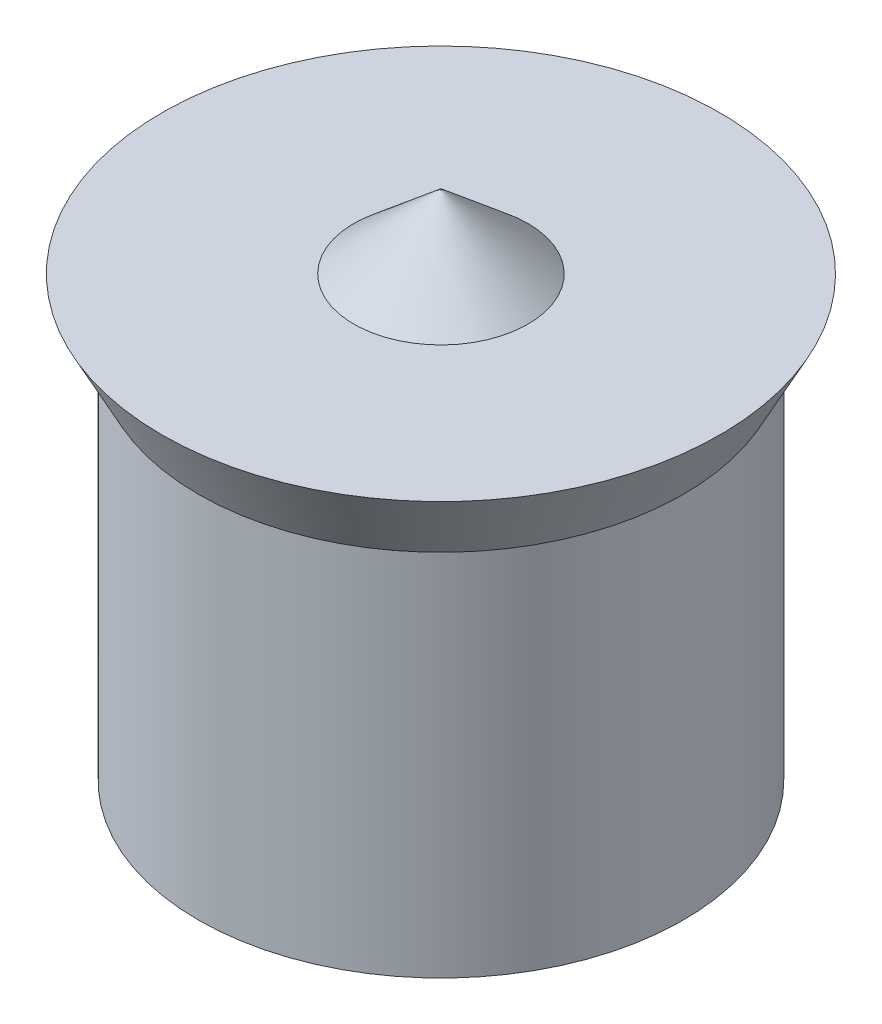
SolidWorks part; units mm, degrees
ref_plane "Front Plane" through (0, 0, 0) normal (0, 0, 1) x (1, 0, 0)
ref_plane "Top Plane" through (0, 0, 0) normal (0, 1, 0) x (1, 0, 0)
ref_plane "Right Plane" through (0, 0, 0) normal (1, 0, 0) x (0, 0, -1)
sketch "Sketch1" plane through (0, 0, 0) normal (0, 1, 0) x (1, 0, 0)
  circle A0 centre (0, 0) radius 36.5
  dimension "D1" = 73
extrude "Boss-Extrude1" add sketch "Sketch1" along normal blind 55.5
ref_plane "Plane1" through (0, 66, 0) normal (0, 1, 0) x (1, 0, 0)
sketch "Sketch2" plane through (0, 66, 0) normal (0, 1, 0) x (1, 0, 0)
  circle A0 centre (0, 0) radius 42
  dimension "D1" = 84
loft "Loft3" add profiles "Sketch2"
ref_plane "Plane2" through (0, -21, 0) normal (0, -1, 0) x (-1, 0, 0)
sketch "Sketch3" plane through (0, -21, 0) normal (0, -1, 0) x (-1, 0, 0)
  circle A0 centre (0, 0) radius 2.5
  dimension "D1" = 5
loft "Loft4" add profiles "Sketch3"
ref_plane "Plane3" through (0, 77, 0) normal (0, -1, 0) x (-1, 0, 0)
sketch "Sketch4" plane through (0, 77, 0) normal (0, -1, 0) x (-1, 0, 0)
  circle A0 centre (0, 0) radius 0.1173
sketch "Sketch5" plane through (0, 66, 0) normal (0, 1, 0) x (1, 0, 0)
  circle A0 centre (0, 0) radius 13.1201
loft "Loft5" add profiles "Sketch5", "Sketch4"
